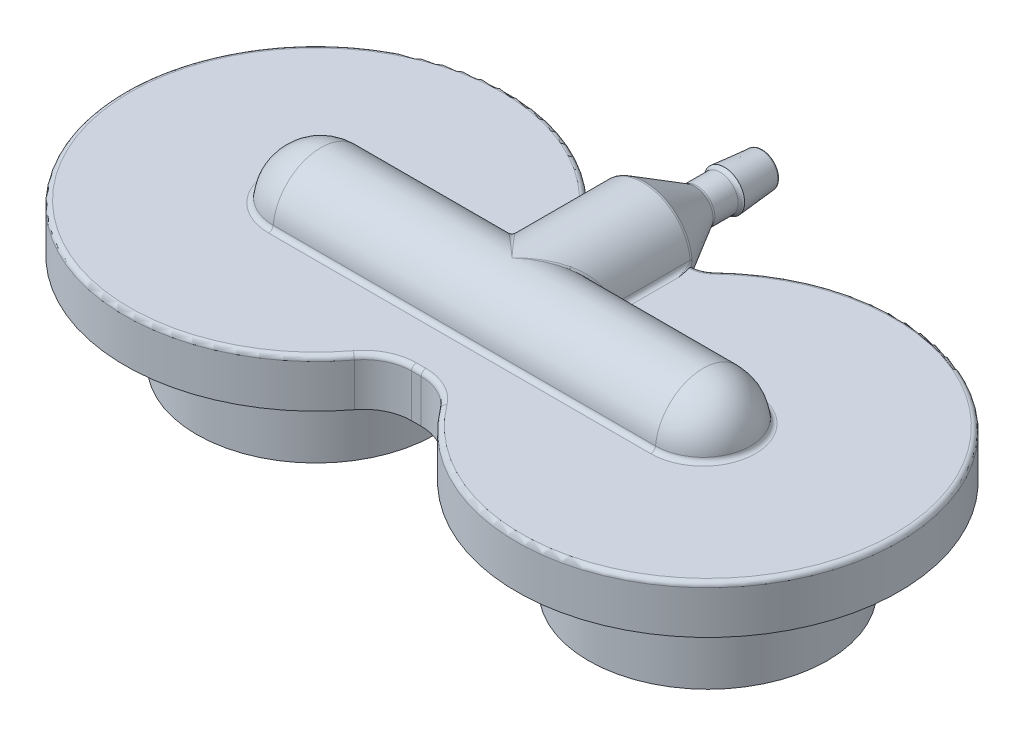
SolidWorks part; units mm, degrees
ref_plane "Front Plane" through (0, 0, 0) normal (0, 0, 1) x (1, 0, 0)
ref_plane "Top Plane" through (0, 0, 0) normal (0, 1, 0) x (1, 0, 0)
ref_plane "Right Plane" through (0, 0, 0) normal (1, 0, 0) x (0, 0, -1)
sketch "Sketch1" plane through (0, 0, 0) normal (0, 1, 0) x (1, 0, 0)
  line L1 (-1.27, -25.4) -> (1.27, -25.4)
  line L2 (0, 0) -> (0, 25.4) construction
  line L3 (0, 0) -> (-20.1297, 0) construction
  line L4 (-12.7, 35.0761) -> (12.7, 35.0761)
  arc A0 (-17.0744, 36.8232) -> (-11.43, -30.48) centre (-52.07, 0) ccw
  circle A1 centre (-52.07, 0) radius 50.8 construction
  circle A2 centre (52.07, 0) radius 50.8 construction
  arc A3 (17.0744, 36.8232) -> (11.43, -30.48) centre (52.07, 0) cw
  arc A4 (11.43, -30.48) -> (1.27, -25.4) centre (1.27, -38.1) ccw
  arc A5 (-1.27, -25.4) -> (-11.43, -30.48) centre (-1.27, -38.1) ccw
  arc A8 (17.0744, 36.8232) -> (12.7, 35.0761) centre (12.7, 41.4261) cw
  arc A9 (-12.7, 35.0761) -> (-17.0744, 36.8232) centre (-12.7, 41.4261) cw
  point P5 (0, 50.8)
  point P13 (0, -50.8)
  point P15 (8.0759, -25.4)
  point P18 (-8.0759, -25.4)
  point P26 (15.3235, 35.0761)
  point P29 (-15.3235, 35.0761)
  dimension "D1" = 101.6
  dimension "D2" = 101.6
  dimension "D3" = 2.54
  dimension "D4" = 12.7
  dimension "D7" = 6.35
  dimension "D5" = 25.4
  dimension "D6" = 25.4
extrude "Boss-Extrude1" add sketch "Sketch1" against normal blind 12.7
sketch "Sketch2" plane through (0, -12.7, 0) normal (0, -1, 0) x (1, 0, 0)
  circle A0 centre (-52.07, 0) radius 31.75
  circle A1 centre (52.07, 0) radius 31.75
  dimension "D1" = 63.5
extrude "Boss-Extrude2" add sketch "Sketch2" along normal blind 25.4
sketch "Sketch3" plane through (0, 0, 0) normal (0, 1, 0) x (1, 0, 0)
  line L0 (-63.5, 0) -> (63.5, 0) construction
  line L1 (-50.8, 12.7) -> (50.8, 12.7)
  line L2 (-63.5, 0) -> (63.5, 0)
  arc A0 (-50.8, 12.7) -> (-63.5, 0) centre (-50.8, 0) ccw
  arc A1 (50.8, 12.7) -> (63.5, 0) centre (50.8, 0) cw
  dimension "D1" = 12.7
  dimension "D2" = 127
revolve "Revolve1" add sketch "Sketch3" angle 180 about L0
sketch "Sketch23" plane through (0, 0, 0) normal (0, 1, 0) x (1, 0, 0)
  line L0 (55.1665, 93.831) -> (50.8, 0) construction
  line L1 (50.8, -12.7) -> (50.8, 12.7) construction
  line L2 (54.241, 73.9419) -> (50.8, 0)
  line L3 (40.9643, 61.846) -> (38.1034, 0.3692)
  line L4 (38.1034, 0.3692) -> (50.8, 0)
  arc A0 (40.9643, 61.846) -> (54.241, 73.9419) centre (53.6506, 61.2556) cw
  dimension "D1" = 12.7
  dimension "D2" = 6.35
revolve "Revolve4" [suppressed] add sketch "Sketch23" angle 180 about L0
mirror "Mirror5" [suppressed] about plane through (0, 0, 0) normal (1, 0, 0)
sketch "Sketch26" [suppressed] plane through (0, -12.7, 0) normal (0, -1, 0) x (1, 0, 0)
  line L5 (0, -72.632) -> (0, 0) construction
  line L6 (-66.3369, -60.6653) -> (-65.7899, -48.9122)
  line L7 (40.3869, -49.4383) -> (40.9643, -61.846)
  line L8 (66.3369, -60.6653) -> (65.7899, -48.9122)
  line L9 (40.3869, -49.4383) -> (40.9643, -61.846)
  line L10 (66.3369, -60.6653) -> (65.7899, -48.9122)
  line L11 (-40.3869, -49.4383) -> (-40.9643, -61.846)
  arc A8 (-40.9643, -61.846) -> (-66.3369, -60.6653) centre (-53.6506, -61.2556) cw
  arc A9 (-40.3869, -49.4383) -> (-65.7899, -48.9122) centre (-52.07, 0) cw
  arc A10 (40.3869, -49.4383) -> (65.7899, -48.9122) centre (52.07, 0) ccw
  arc A11 (40.9643, -61.846) -> (66.3369, -60.6653) centre (53.6506, -61.2556) ccw
  arc A12 (40.3869, -49.4383) -> (65.7899, -48.9122) centre (52.07, 0) ccw
  arc A13 (40.9643, -61.846) -> (66.3369, -60.6653) centre (53.6506, -61.2556) ccw
  dimension "D1" = 0
extrude "Boss-Extrude4" [suppressed] add sketch "Sketch26" against normal up to surface (12.7 mm away)
sketch "Sketch4" plane through (0, 0, 0) normal (0, 1, 0) x (1, 0, 0)
  line L0 (0, 0) -> (0, 66.5967) construction
  line L1 (0, 0) -> (0, 25.4) construction
  line L2 (0, 35.0761) -> (-12.7, 35.0761)
  line L3 (-12.7, 35.0761) -> (-12.7, 0)
  line L4 (-12.7, 0) -> (0, 0)
  line L5 (0, 0) -> (0, 35.0761)
  line L7 (12.7, 35.0761) -> (-12.7, 35.0761) construction
  dimension "D2" = 12.7
revolve "Revolve2" add sketch "Sketch4" angle 360 about L0
sketch "Sketch8" plane through (0, 0, 0) normal (0, 0, 1) x (1, 0, 0)
  line L0 (-52.07, -38.1) -> (-52.07, -15.8596)
  line L1 (-83.82, -38.1) -> (-20.32, -38.1) construction
  line L2 (-1.27, 0) -> (-102.87, 0) construction
  line L3 (52.07, -38.1) -> (52.07, -15.8596)
  line L4 (20.32, -38.1) -> (83.82, -38.1) construction
  line L5 (102.87, 0) -> (1.27, 0) construction
  line L6 (0, 0) -> (0, -42.1696) construction
  line L7 (-3.2555, 0) -> (3.2555, 0)
  line L8 (-4.3624, -0.0483) -> (-40.4769, -3.2079)
  line L9 (4.3624, -0.0483) -> (40.4769, -3.2079)
  arc A0 (52.07, -15.8596) -> (40.4769, -3.2079) centre (39.37, -15.8596) ccw
  arc A1 (-52.07, -15.8596) -> (-40.4769, -3.2079) centre (-39.37, -15.8596) cw
  arc A2 (4.3624, -0.0483) -> (3.2555, 0) centre (3.2555, -12.7) ccw
  arc A3 (-3.2555, 0) -> (-4.3624, -0.0483) centre (-3.2555, -12.7) ccw
  point P14 (52.07, 0)
  point P17 (-52.07, 0)
  point P24 (0, 0)
  point P27 (3.81, 0)
  point P30 (-3.81, 0)
  dimension "D1" = 12.7
  dimension "D3" = 12.7
  dimension "D2" = 3.81
  dimension "D4" = 95
sketch "Sketch9" plane through (0, -38.1, 0) normal (0, -1, 0) x (1, 0, 0)
  circle A0 centre (-52.07, 0) radius 3.175
  dimension "D1" = 6.35
sweep "Cut-Sweep1" cut profiles "Sketch9" path "Sketch8"
sketch "Sketch11" plane through (0, 0, 0) normal (0, 0, 1) x (1, 0, 0)
  line L0 (52.07, -38.1) -> (52.07, 29.0023) construction
  line L1 (52.07, -38.1) -> (52.07, -12.7) construction
  line L2 (52.07, -17.78) -> (55.245, -17.78)
  line L3 (55.245, -17.78) -> (78.74, -38.1)
  line L4 (20.32, -38.1) -> (83.82, -38.1) construction
  line L5 (78.74, -38.1) -> (52.07, -38.1)
  line L6 (52.07, -38.1) -> (52.07, -17.78)
  dimension "D1" = 3.175
  dimension "D2" = 5.08
  dimension "D3" = 20.32
revolve "Cut-Revolve1" cut sketch "Sketch11" angle 360 about L0
mirror "Mirror1" about plane through (0, 0, 0) normal (1, 0, 0) of "Cut-Revolve1"
sketch "Sketch12" plane through (0, 0, 0) normal (0, 1, 0) x (1, 0, 0)
  line L0 (0, 35.0761) -> (0, 88.7437) construction
  line L1 (12.7, 35.0761) -> (-12.7, 35.0761) construction
  line L2 (0, 0) -> (0, 25.4) construction
  line L3 (0, 35.0761) -> (-12.7, 35.0761)
  line L4 (-12.7, 35.0761) -> (-4.7625, 48.8243)
  line L5 (-4.7625, 48.8243) -> (-4.7625, 56.4443)
  line L6 (-4.7625, 56.4443) -> (-5.3975, 56.4443)
  line L7 (-5.3975, 56.4443) -> (-4.5086, 66.6043)
  line L8 (-4.5086, 66.6043) -> (0, 66.6043)
  line L9 (0, 66.6043) -> (0, 35.0761)
  dimension "D1" = 10.795
  dimension "D2" = 85
  dimension "D3" = 9.525
  dimension "D4" = 7.62
  dimension "D6" = 60
  dimension "D7" = 10.16
revolve "Revolve3" add sketch "Sketch12" angle 360 about L0
sketch "Sketch13" plane through (0, 0, -66.6043) normal (0, 0, -1) x (-1, 0, 0)
  circle A0 centre (0, 0) radius 3.175
  dimension "D1" = 6.35
extrude "Cut-Extrude5" cut sketch "Sketch13" against normal up to next
ref_plane "Plane1" through (0, 12.7, 0) normal (0, 1, 0) x (1, 0, 0)
ref_plane "Plane13" [suppressed] through (0, 12.6981, 0) normal (0, 1, 0) x (1, 0, 0)
sketch "Sketch14" [suppressed] plane through (0, 12.6981, 0) normal (0, 1, 0) x (1, 0, 0)
  circle A0 centre (0, 0) radius 10.16
  dimension "D1" = 20.32
extrude "Boss-Extrude3" [suppressed] add sketch "Sketch14" against normal up to body
sketch "Sketch22" [suppressed] plane through (6.7411, 12.6981, -2.7075) normal (0, -1, 0) x (1, 0, 0)
  line L0 (-3.5737, 2.9272) -> (-9.9085, 2.4878) construction
  line L1 (3.175, 0) -> (2.7357, 6.3348) construction
  circle A0 centre (-6.7411, 2.7075) radius 10.16 construction
  point P5 (-6.7411, 2.7075)
  dimension "D3" = 6.35
ref_plane "Plane12" [suppressed] through (0, 12.6981, 0) normal (-0.9976, 0, -0.0692) x (-0.0692, 0, 0.9976)
sketch "Port Sketch" [suppressed] plane through (0.1959, 12.6981, -2.8252) normal (0.9976, 0, 0.0692) x (-0.0692, 0, 0.9976)
  line L0 (2.832, 0) -> (2.832, 45.0293) construction
  line L1 (2.832, 15.6756) -> (6.2864, 13.6)
  line L2 (6.2864, 13.6) -> (6.2864, 11.6)
  line L3 (6.2864, 11.6) -> (6.8007, 11.6)
  line L4 (6.8007, 11.6) -> (6.8007, 3.6542)
  line L5 (6.8007, 3.6542) -> (6.7549, 3.7)
  line L6 (6.7549, 3.7) -> (7.1585, 1.8012)
  line L7 (7.407, 1.6) -> (11.332, 1.6)
  line L8 (11.332, 1.6) -> (11.332, 0)
  line L10 (11.332, 0) -> (2.832, 0)
  line L11 (2.832, 0) -> (2.832, 15.6756)
  line L12 (-1.091, 3.7) -> (-1.4946, 1.8012) construction
  line L13 (-1.1368, 3.6542) -> (-1.091, 3.7) construction
  line L14 (2.832, 15.6756) -> (-0.6224, 13.6) construction
  arc A0 (7.1585, 1.8012) -> (7.407, 1.6) centre (7.407, 1.854) ccw
  dimension "D1" = 0.254
  dimension "Countersink angle" = 118
  dimension "D3" = 45
  dimension "TapDrillDia" = 6.9088
  dimension "D5" = 9.15
  dimension "ThdMjr" = 7.9375
  dimension "SpotDia" = 17
  dimension "L3" = 1.6
  dimension "L1" = 2.1
  dimension "ThdDp" = 10
  dimension "TapDrillDp" = 12
  dimension "K" = 12
revolve "SAE Port" [suppressed] cut sketch "Port Sketch" angle 360 about L0
other "saePorts-GM<1>" [suppressed]
fillet "Fillet3" radius 1.27 9 edges at (-31.75, 0, -12.7) (-63.5, 0, 0) (0, 0, 12.7) (63.5, 0, 0) (-8.9803, 8.9803, -8.9803) (8.9803, 8.9803, -8.9803) (31.75, 0, -12.7) (12.7, 0, -23.8881) (-12.7, 0, -23.8881)
fillet "Fillet4" radius 1.27 3 edges at (12.7668, 0.7213, -34.9251) (-12.7814, 0.6918, -34.9027) (0, 12.7, -35.0761)
fillet "Fillet5" radius 1.27 2 edges at (4.7625, 0, -56.4443) (4.7625, 0, -48.8243)
fillet "Fillet6" [suppressed] radius 1.27
fillet "Fillet9" radius 0.508 2 edges at (-3.175, 0, -66.6043) (4.5086, 0, -66.6043)
fillet "Fillet10" radius 1.27 7 edges at (-15.0552, 0, -35.5291) (-102.6923, 0, 4.2455) (-6.9496, 0, 26.7408) (0, 0, 25.4) (6.9496, 0, 26.7408) (15.0552, 0, -35.5291) (102.6923, 0, 4.2455)
hole_wizard "CBORE for #8 Socket Head Cap Screw1" positions "Sketch28" profile "Sketch27" counterbore size "#8" standard "ANSI Inch"
sketch "Sketch28" [suppressed] plane through (0, 12.6981, 0) normal (0, 1, 0) x (1, 0, 0)
  point P0 (53.9455, 67.5919)
  point P4 (-53.9455, 67.5919)
sketch "Sketch27" plane through (53.9455, 12.6981, -67.5919) normal (1, 0, 0) x (0, 0, 1)
  line L0 (0, 0) -> (0, 50.7981)
  line L1 (0, 50.7981) -> (2.4574, 50.7981)
  line L3 (2.4574, 50.7981) -> (2.4574, 9.2456)
  line L4 (2.4574, 9.2456) -> (3.9687, 9.2456)
  line L5 (3.9687, 9.2456) -> (3.9687, 0)
  line L7 (3.9687, 0) -> (0, 0)
  line L11 (0, -6.35) -> (0, 107.95) construction
  dimension "Thru Hole Dia." = 4.9149
  dimension "Thru Hole Depth" = 50.7981
  dimension "C'Bore Dia." = 7.9375
  dimension "C'Bore Depth" = 9.2456
